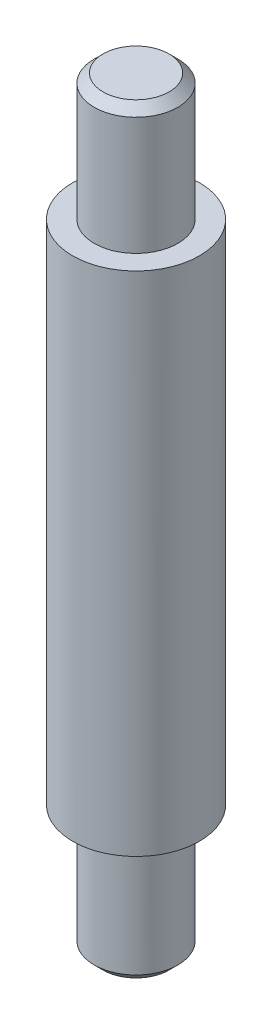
SolidWorks part; units mm, degrees
ref_plane "Front Plane" through (0, 0, 0) normal (0, 0, 1) x (1, 0, 0)
ref_plane "Top Plane" through (0, 0, 0) normal (0, 1, 0) x (1, 0, 0)
ref_plane "Right Plane" through (0, 0, 0) normal (1, 0, 0) x (0, 0, -1)
sketch "Sketch1" plane through (0, 0, 0) normal (0, 1, 0) x (1, 0, 0)
  circle A0 centre (0, 0) radius 2.5
  dimension "D1" = 5
extrude "Extrude1" add sketch "Sketch1" along normal blind 30
sketch "Sketch2" plane through (0, 30, 0) normal (0, 1, 0) x (1, 0, 0)
  circle A0 centre (0, 0) radius 4.9939
  circle A1 centre (0, 0) radius 1.65
  dimension "D1" = 3.3
extrude "Extrude2" cut sketch "Sketch2" against normal blind 5
sketch "Sketch3" plane through (0, 0, 0) normal (0, -1, 0) x (1, 0, 0)
  circle A0 centre (0, 0) radius 1.65
  circle A1 centre (0, 0) radius 5.0813
  dimension "D1" = 3.3
extrude "Extrude3" cut sketch "Sketch3" against normal blind 5
chamfer "Chamfer1" distance 0.35 angle 45 2 edges at (0, 30, 1.65) (0, 0, -1.65)
